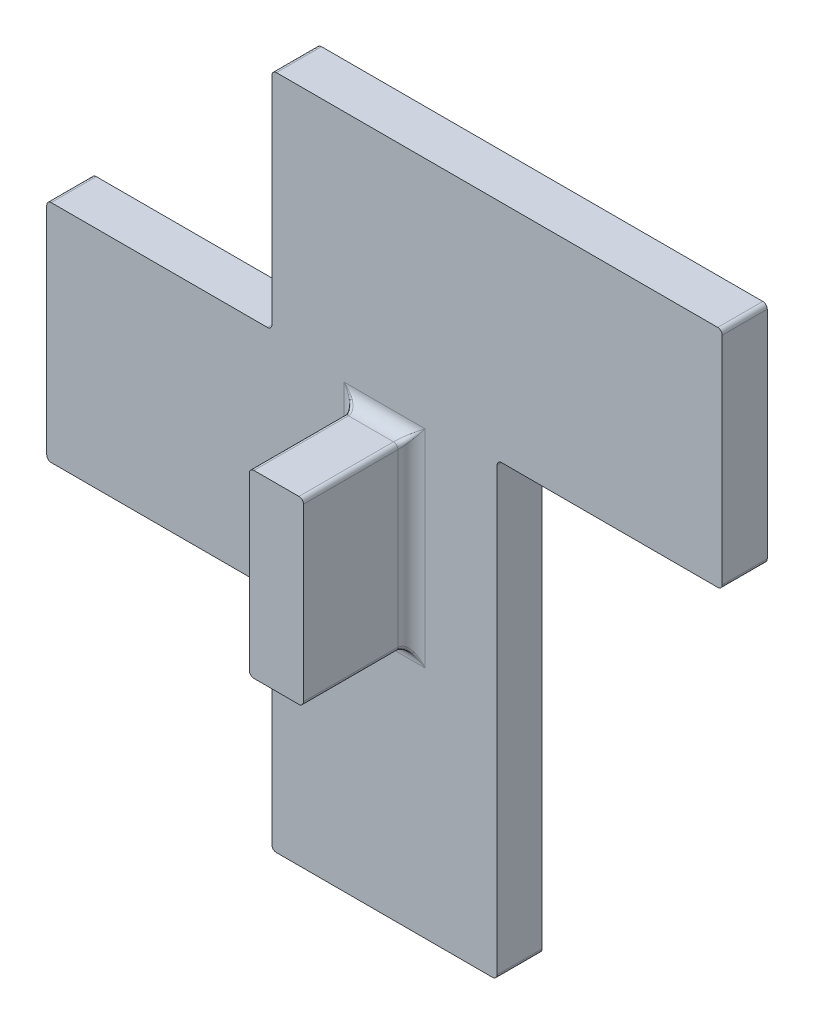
SolidWorks part; units mm, degrees
ref_plane "Ebene vorne" through (0, 0, 0) normal (0, 0, 1) x (1, 0, 0)
ref_plane "Ebene oben" through (0, 0, 0) normal (0, 1, 0) x (1, 0, 0)
ref_plane "Ebene rechts" through (0, 0, 0) normal (1, 0, 0) x (0, 0, -1)
sketch "Skizze1" plane through (0, 0, 0) normal (0, 0, 1) x (1, 0, 0)
  line L0 (0, 0) -> (0, 25)
  line L1 (0, 25) -> (-25, 25)
  line L2 (-25, 25) -> (-25, 50)
  line L3 (-25, 50) -> (0, 50)
  line L4 (0, 50) -> (0, 75)
  line L5 (0, 75) -> (50, 75)
  line L6 (50, 75) -> (50, 50)
  line L7 (50, 50) -> (25, 50)
  line L8 (25, 50) -> (25, 0)
  line L9 (25, 0) -> (0, 0)
  dimension "D1" = 25
extrude "Aufsatz-Linear austragen1" add sketch "Skizze1" along normal blind 5
fillet "Verrundung1" radius 0.5 10 edges at (50, 50, 2.5) (25, 50, 2.5) (25, 0, 2.5) (0, 25, 2.5) (50, 75, 2.5) (0, 0, 2.5) (-25, 25, 2.5) (0, 75, 2.5) (0, 50, 2.5) (-25, 50, 2.5)
sketch "Skizze2" plane through (0, 0, 5) normal (0, 0, 1) x (1, 0, 0)
  line L0 (0.5, 0) -> (24.5, 0) construction
  line L1 (9.5, 47.5) -> (15.5, 47.5)
  line L2 (9.5, 47.5) -> (9.5, 27.5)
  line L3 (9.5, 27.5) -> (15.5, 27.5)
  line L4 (15.5, 47.5) -> (15.5, 27.5)
  line L5 (-25, 49.5) -> (-25, 25.5) construction
  point P6 (12.5, 0)
  point P7 (12.5, 27.5)
  point P8 (-25, 37.5)
  point P11 (9.5, 37.5)
  dimension "D1" = 20
  dimension "D2" = 6
extrude "Aufsatz-Linear austragen2" add sketch "Skizze2" along normal blind 12
fillet "Verrundung2" radius 1.5 4 edges at (12.5, 47.5, 5) (9.5, 37.5, 5) (12.5, 27.5, 5) (15.5, 37.5, 5)
fillet "Verrundung3" radius 0.5 8 edges at (15.9393, 47.9393, 5.4393) (9.0607, 47.9393, 5.4393) (15.9393, 27.0607, 5.4393) (9.0607, 27.0607, 5.4393) (15.5, 47.5, 11.75) (9.5, 47.5, 11.75) (15.5, 27.5, 11.75) (9.5, 27.5, 11.75)
